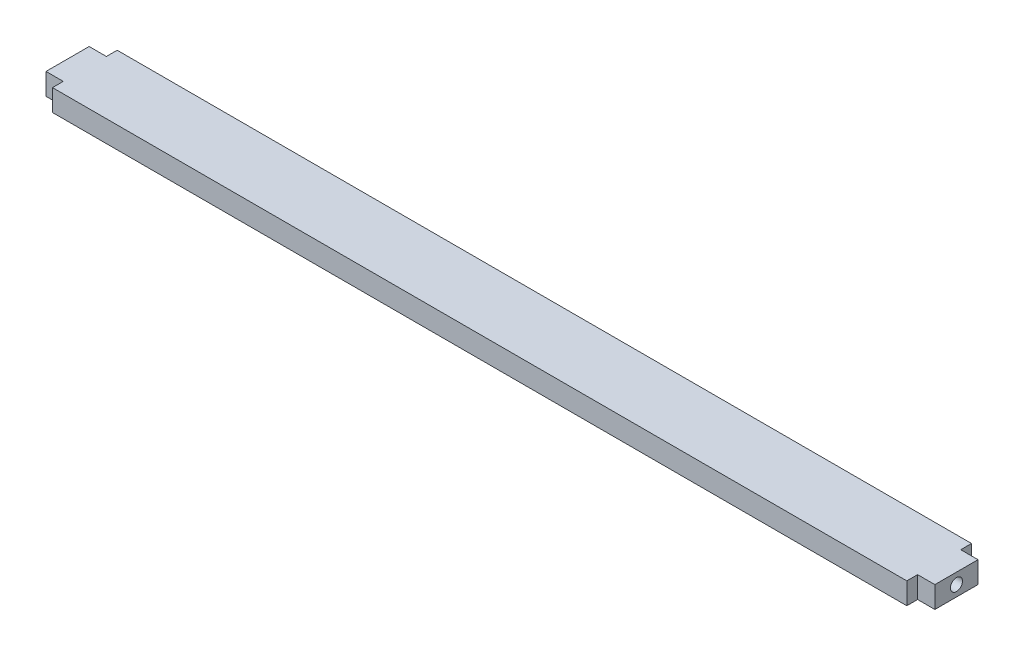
SolidWorks part; units mm, degrees
ref_plane "前视基准面" through (0, 0, 0) normal (0, 0, 1) x (1, 0, 0)
ref_plane "上视基准面" through (0, 0, 0) normal (0, 1, 0) x (1, 0, 0)
ref_plane "右视基准面" through (0, 0, 0) normal (1, 0, 0) x (0, 0, -1)
sketch "草图1" plane through (0, 0, 0) normal (0, 1, 0) x (1, 0, 0)
  line L0 (-99, 7.5) -> (-99, 5)
  line L1 (-99, 7.5) -> (99, 7.5)
  line L2 (-103, 5) -> (-103, -5)
  line L3 (-99, -7.5) -> (99, -7.5)
  line L4 (103, 5) -> (103, -5)
  line L5 (-102.894, 7.5285) -> (85.2006, -6.2339) construction
  line L6 (-103.0022, -7.4711) -> (85.1011, 6.1727) construction
  line L7 (-103, 5) -> (-99, 5)
  line L8 (-99, -7.1809) -> (-99, -7.5)
  line L9 (0, 126.5206) -> (0, -105.4988) construction
  line L10 (-242.8207, 0) -> (244.7563, 0) construction
  line L11 (-99, -7.5) -> (-99, -5)
  line L12 (-103, -5) -> (-99, -5)
  line L13 (99, -7.5) -> (99, -5)
  line L14 (103, -5) -> (99, -5)
  line L15 (103, 5) -> (99, 5)
  line L16 (99, 7.5) -> (99, 5)
  point P0 (0, 0)
  dimension "D1" = 206
  dimension "D3" = 4
  dimension "D4" = 2.5
  dimension "D5" = 15
extrude "凸台-拉伸1" add sketch "草图1" along normal blind 5 contours L3 L13 L14 L4 L15 L16 L1 L0 L7 L2 L12 L11
sketch "草图2" plane through (0, 0, 0) normal (1, 0, 0) x (0, 0, -1)
  line L0 (0, 8.136) -> (0, -2.3993) construction
  circle A0 centre (0, 2.5) radius 1.4
  dimension "D1" = 2.8
  dimension "D2" = 2.5
extrude "切除-拉伸1" cut sketch "草图2" along normal blind 10 from offset 93
mirror "镜向1" about plane through (0, 0, 0) normal (1, 0, 0) of "切除-拉伸1"
